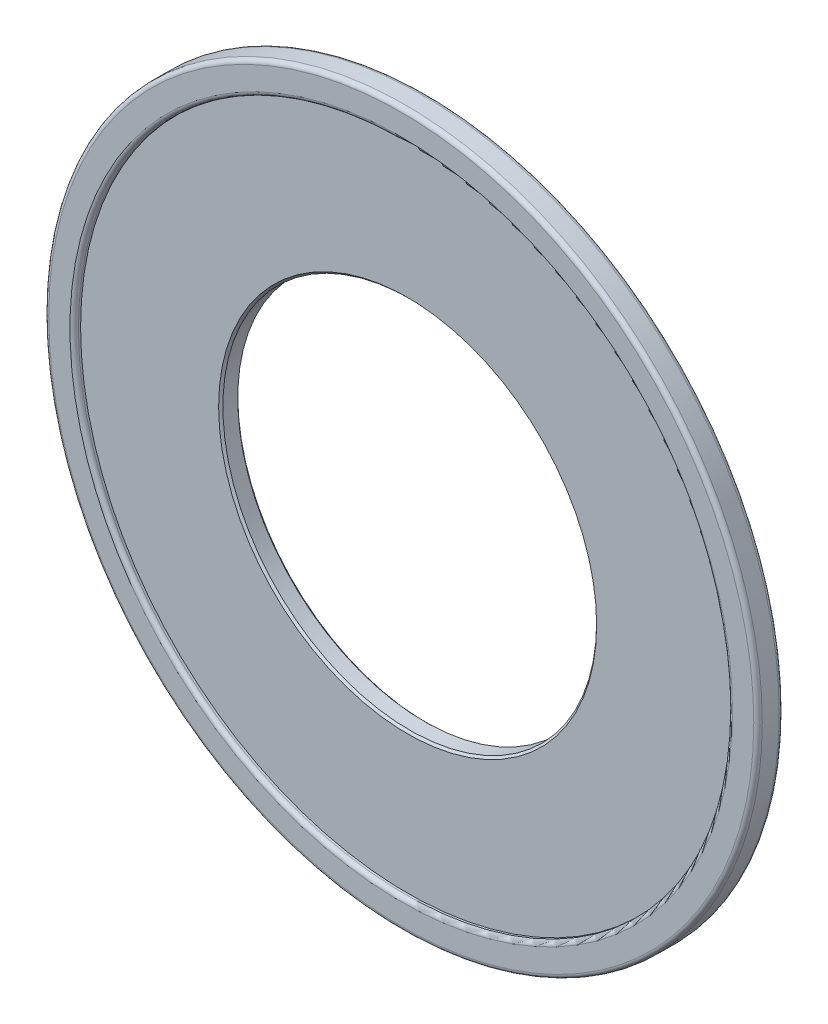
SolidWorks part; units mm, degrees
ref_plane "Спереди" through (0, 0, 0) normal (0, 0, 1) x (1, 0, 0)
ref_plane "Сверху" through (0, 0, 0) normal (0, 1, 0) x (1, 0, 0)
ref_plane "Справа" through (0, 0, 0) normal (1, 0, 0) x (0, 0, -1)
sketch "Эскиз1" plane through (0, 0, 0) normal (0, 0, 1) x (1, 0, 0)
  circle A0 centre (0, 0) radius 44
  circle A1 centre (0, 0) radius 77 construction
  circle A2 centre (0, 0) radius 84
  dimension "D1" = 88
  dimension "D2" = 154
  dimension "D3" = 168
extrude "Бобышка-Вытянуть1" add sketch "Эскиз1" along normal blind 6
sketch "Эскиз2" plane through (0, 0, 6) normal (0, 0, 1) x (1, 0, 0)
  circle A0 centre (0, 0) radius 77 construction
  circle A3 centre (0, 0) radius 77
extrude "Вырез-Вытянуть1" cut sketch "Эскиз2" against normal blind 1.5
fillet "Скругление1" radius 1 3 edges at (84, 0, 0) (84, 0, 6) (77, 0, 6)
chamfer "Фаска1" distance 0.5 angle 45 2 edges at (44, 0, 4.5) (44, 0, 0)
